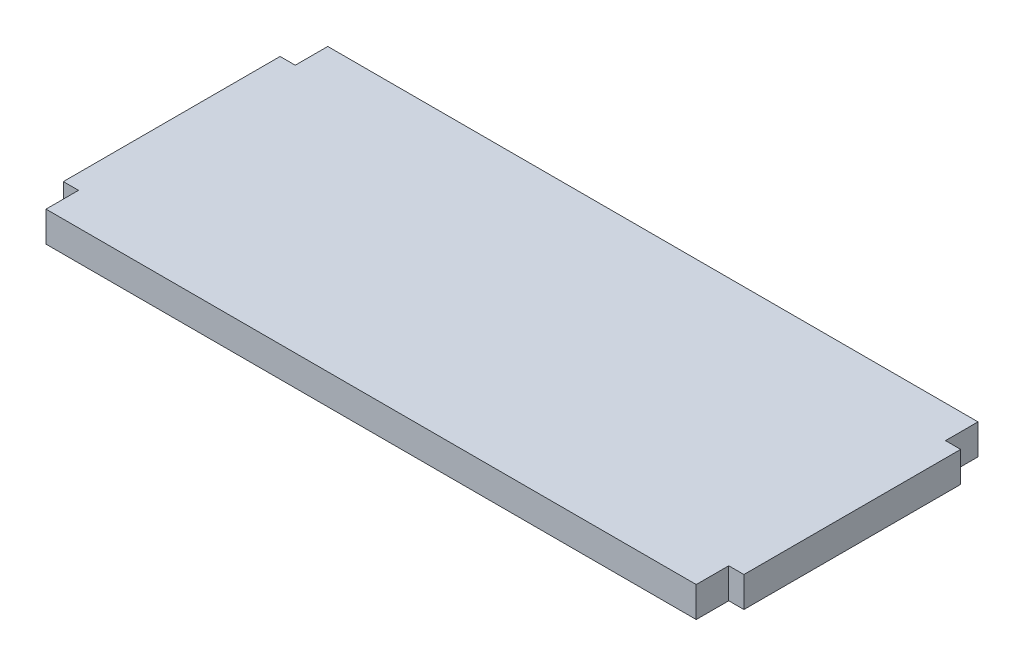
SolidWorks part; units mm, degrees
ref_plane "Front Plane" through (0, 0, 0) normal (0, 0, 1) x (1, 0, 0)
ref_plane "Top Plane" through (0, 0, 0) normal (0, 1, 0) x (1, 0, 0)
ref_plane "Right Plane" through (0, 0, 0) normal (1, 0, 0) x (0, 0, -1)
sketch "Sketch1" plane through (0, 0, 0) normal (0, 1, 0) x (1, 0, 0)
  line L1 (7, 0) -> (307, 0)
  line L2 (0, -15) -> (0, -115)
  line L3 (7, -130) -> (307, -130)
  line L4 (314, -15) -> (314, -115)
  line L5 (307, 0) -> (307, -15)
  line L6 (0, -15) -> (7, -15)
  line L7 (0, -15) -> (0, -115)
  line L8 (0, -115) -> (7, -115)
  line L9 (314, -15) -> (314, -115)
  line L10 (7, 0) -> (7, -15)
  line L11 (307, -115) -> (314, -115)
  line L12 (307, -15) -> (314, -15)
  line L13 (307, -115) -> (307, -130)
  line L14 (7, -115) -> (7, -130)
  dimension "D1" = 130
  dimension "D2" = 300
  dimension "D3" = 15
  dimension "D4" = 15
  dimension "D5" = 7
  dimension "D6" = 7
extrude "Boss-Extrude1" add sketch "Sketch1" along normal blind 14 contours L8 L14 L3 L13 L11 L4 L12 L5 L1 L10 L6 L2
